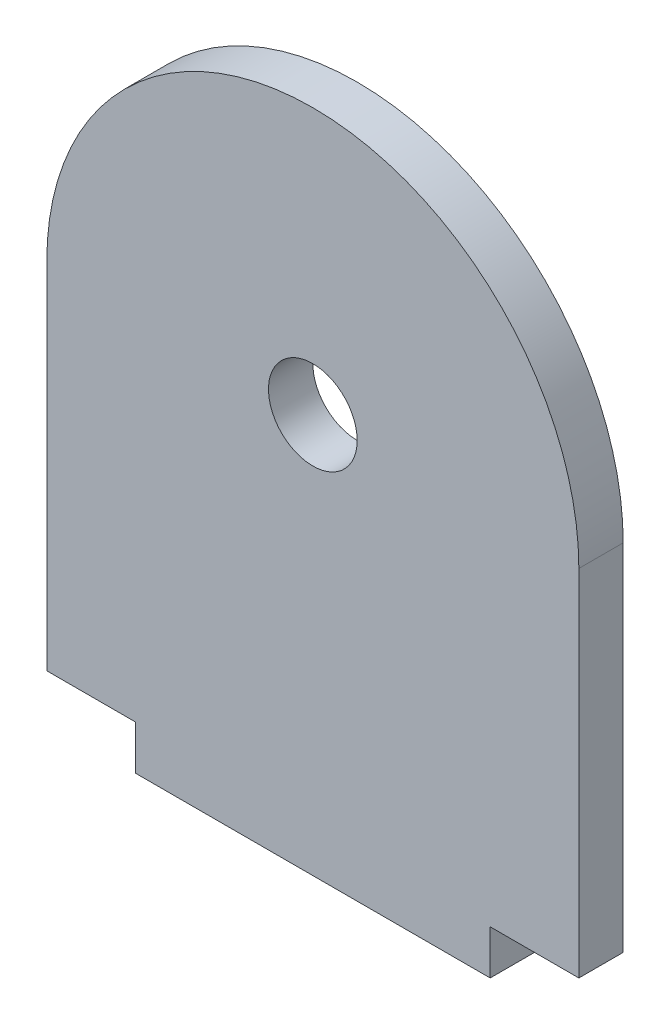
SolidWorks part; units mm, degrees
ref_plane "Front Plane" through (0, 0, 0) normal (0, 0, 1) x (1, 0, 0)
ref_plane "Top Plane" through (0, 0, 0) normal (0, 1, 0) x (1, 0, 0)
ref_plane "Right Plane" through (0, 0, 0) normal (1, 0, 0) x (0, 0, -1)
sketch "Sketch1" plane through (0, 0, 0) normal (0, 0, 1) x (1, 0, 0)
  line L0 (-28.4544, -6.3394) -> (-22.1044, -6.3394)
  line L2 (-60.2044, 19.0606) -> (-60.2044, -6.3394)
  line L3 (-60.2044, -6.3394) -> (-53.8544, -6.3394)
  line L4 (-22.1044, 19.0606) -> (-22.1044, -6.3394)
  line L6 (-53.8544, -6.3394) -> (-53.8544, -9.5144)
  line L7 (-53.8544, -9.5144) -> (-28.4544, -9.5144)
  line L8 (-28.4544, -6.3394) -> (-28.4544, -9.5144)
  arc A0 (-22.1044, 19.0606) -> (-60.2044, 19.0606) centre (-41.1544, 19.0606) ccw
  circle A1 centre (-41.1544, 19.0606) radius 3.175
  dimension "D6" = 6.35
  dimension "D1" = 25.4
  dimension "D2" = 38.1
  dimension "D3" = 3.175
  dimension "D4" = 25.4
  dimension "D5" = 6.35
extrude "Boss-Extrude1" add sketch "Sketch1" along normal blind 3.175
